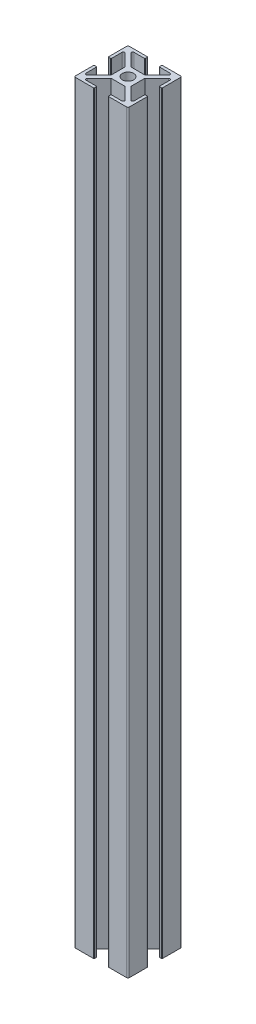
SolidWorks part; units mm, degrees
ref_plane "Front Plane" through (0, 0, 0) normal (0, 0, 1) x (1, 0, 0)
ref_plane "Top Plane" through (0, 0, 0) normal (0, 1, 0) x (1, 0, 0)
ref_plane "Right Plane" through (0, 0, 0) normal (1, 0, 0) x (0, 0, -1)
sketch "Sketch2" plane through (0, 0, 0) normal (0, 1, 0) x (1, 0, 0)
  line L12 (-10, -8.9393) -> (8.9393, 10)
  line L13 (-3.66, -3.66) -> (3.66, -3.66)
  line L26 (-3.66, -3.66) -> (-3.66, 3.66)
  line L27 (-3.66, 3.66) -> (3.66, 3.66)
  line L32 (3.66, -3.66) -> (3.66, 3.66)
  line L37 (-3.66, -3.66) -> (3.66, 3.66) construction
  line L50 (-3.66, 3.66) -> (3.66, -3.66) construction
  line L51 (-10, -8.9393) -> (-8.9393, -10)
  line L52 (8.9393, 10) -> (10, 8.9393)
  line L53 (-8.9393, -10) -> (10, 8.9393)
  line L54 (-10, -8.9393) -> (10, 8.9393) construction
  line L55 (8.9393, 10) -> (-8.9393, -10) construction
  line L56 (0, 0) -> (0, 25.4805) construction
  line L57 (10, 8.9393) -> (2.63, 8.9393)
  line L58 (-10, -8.9393) -> (-10, -10)
  line L59 (-10, -10) -> (-8.9393, -10)
  line L60 (10, 8.9393) -> (10, 10)
  line L61 (10, 10) -> (2.63, 10)
  line L62 (2.63, 8.9393) -> (2.63, 10)
  line L63 (5.995, 7.0557) -> (5.995, 8.9393)
  line L64 (10, 10) -> (10, 2.63)
  line L65 (8.9393, 10) -> (10, 10)
  line L66 (8.9393, 2.63) -> (10, 2.63)
  line L67 (8.9393, 10) -> (8.9393, 2.63)
  circle A0 centre (0, 0) radius 2.095
  point P0 (0, 0)
  dimension "D3" = 4.19
  dimension "D1" = 7.32
  dimension "D2" = 7.32
  dimension "D4" = 20
  dimension "D5" = 1.5
  dimension "D6" = 2.63
  dimension "D8" = 5.995
  dimension "D7" = 90
extrude "Boss-Extrude1" add sketch "Sketch2" along normal blind 280 contours L53 L67 L66 L64 | L67 L57 L12 L27 L32 L53 | L67 L12 L57 | L52 L67 L57 | L60 L61 L52 | L57 L67 L53 | L62 L57 L12 L61 | A0 L53 L32 L27 L12 | A0 L53 L13 L32 | A0 L12 L27 L26 | A0 L12 L26 L13 L53
fillet "Fillet1" radius 0.5 3 edges at (7.8787, 140, -8.9393) (8.9393, 140, -7.8787) (10, 140, -10)
fillet "Fillet2" radius 0.25 4 edges at (2.63, 140, -10) (2.63, 140, -8.9393) (8.9393, 140, -2.63) (10, 140, -2.63)
pattern_circular "CirPattern1" count 4 over 360 about axis through (0, 0, 0) along (0, 1, 0) of "Boss-Extrude1", "Fillet2", "Fillet1"
